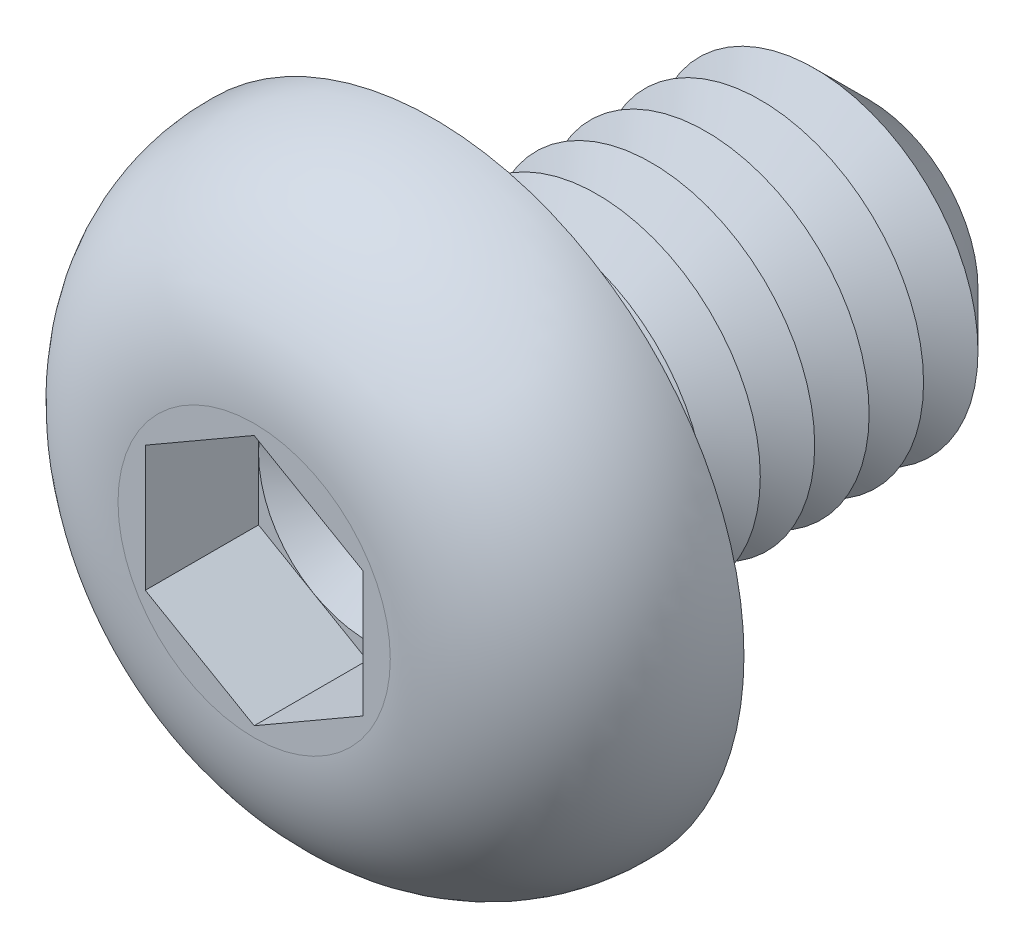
SolidWorks part; units mm, degrees
ref_plane "Front Plane" through (0, 0, 0) normal (0, 0, 1) x (1, 0, 0)
ref_plane "Top Plane" through (0, 0, 0) normal (0, 1, 0) x (1, 0, 0)
ref_plane "Right Plane" through (0, 0, 0) normal (1, 0, 0) x (0, 0, -1)
sketch "Sketch1" plane through (0, 0, 0) normal (1, 0, 0) x (0, 0, -1)
  line L0 (-47.9342, 0) -> (60.3146, 0) construction
sketch "Sketch2" plane through (0, 0, 0) normal (1, 0, 0) x (0, 0, -1)
  line L0 (0, 0) -> (-1.65, 0)
  line L1 (-47.9342, 0) -> (60.3146, 0) construction
  line L2 (-1.65, 0) -> (-1.65, 1.2508)
  line L3 (0, 2.85) -> (0, 0)
  arc A0 (-1.65, 1.2508) -> (0, 2.85) centre (-0.05, 1.2508) cw
  dimension "D1" = 1.6
  dimension "D2" = 1.65
  dimension "D3" = 2.85
revolve "Revolve1" add sketch "Sketch2" angle 360 about L0
sketch "Sketch3" plane through (0, 0, 1.65) normal (0, 0, 1) x (1, 0, 0)
  line L1 (0, 1.1547) -> (-1, 0.5774)
  line L2 (-1, 0.5774) -> (-1, -0.5774)
  line L3 (-1, -0.5774) -> (0, -1.1547)
  line L4 (0, -1.1547) -> (1, -0.5774)
  line L5 (1, -0.5774) -> (1, 0.5774)
  line L6 (1, 0.5774) -> (0, 1.1547)
  circle A0 centre (0, 0) radius 1 construction
  dimension "D1" = 2
extrude "Cut-Extrude1" cut sketch "Sketch3" against normal blind 1.04
sketch "Sketch4" plane through (0, 0, 0) normal (0, 0, -1) x (-1, 0, 0)
  circle A0 centre (0, 0) radius 1.5
  dimension "D1" = 3
extrude "Boss-Extrude1" add sketch "Sketch4" along normal blind 4
chamfer "Chamfer1" distance 0.5 angle 45 1 edges at (-1.5, 0, -4)
sketch "Sketch5" plane through (0, 0, 0) normal (1, 0, 0) x (0, 0, -1)
  line L0 (0.5, 1.5) -> (1, 1.5)
  line L1 (3.5, 1.5) -> (0, 1.5) construction
  line L2 (1, 1.5) -> (0.75, 1.067)
  line L3 (0.75, 1.067) -> (0.5, 1.5)
  line L4 (0, -2.85) -> (0, 2.85) construction
  line L5 (3.5, 1.5) -> (0, 1.5) construction
  dimension "D1" = 0.5
  dimension "D2" = 0.5
revolve "Cut-Revolve1" cut sketch "Sketch5" angle 360 about L0
pattern_linear "LPattern1" count 6 spacing 0.5 along (0, 0, -1) of "Cut-Revolve1"
fillet "Fillet2" radius 0.2 1 edges at (1.5, 0, 0)
sketch "Sketch6" plane through (0, 0, 0.61) normal (0, 0, 1) x (1, 0, 0)
  line L0 (0, -1.1547) -> (1, -0.5774) construction
  circle A0 centre (0, 0) radius 1
extrude "Cut-Extrude2" cut sketch "Sketch6" against normal through all draft 60
